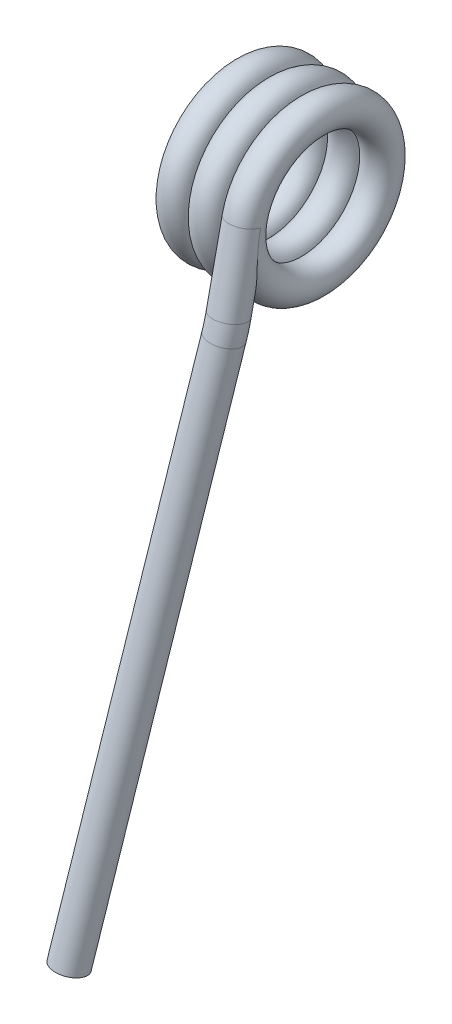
SolidWorks part; units mm, degrees
ref_plane "Front" through (0, 0, 0) normal (0, 0, 1) x (1, 0, 0)
ref_plane "Top" through (0, 0, 0) normal (0, 1, 0) x (1, 0, 0)
ref_plane "Right" through (0, 0, 0) normal (1, 0, 0) x (0, 0, -1)
sketch "Sketch1" plane through (0, 0, 0) normal (0, 0, 1) x (1, 0, 0)
  line L0 (0, 0) -> (-20.6351, 0) construction
  line L1 (0, 3.25) -> (19.7129, 3.25) construction
  line L2 (0.7486, 3.2952) -> (0.7514, 3.2952)
  line L3 (0.7486, 3.2048) -> (0.7514, 3.2048)
  line L4 (2.2486, 3.2952) -> (2.2514, 3.2952)
  line L5 (2.2486, 3.2048) -> (2.2514, 3.2048)
  arc A0 (0.7486, 3.2952) -> (0.7486, 3.2048) centre (0, 3.25) ccw
  arc A1 (0.7514, 3.2048) -> (2.2486, 3.2048) centre (1.5, 3.25) ccw
  arc A2 (2.2514, 3.2048) -> (2.2514, 3.2952) centre (3, 3.25) ccw
  arc A3 (2.2486, 3.2952) -> (0.7514, 3.2952) centre (1.5, 3.25) ccw
  point P7 (0, 2.5)
  dimension "D1" = 1.5
  dimension "D2" = 5
revolve "\"Spring Coil\"- Revolve1" add sketch "Sketch1" angle 360 about L0
ref_plane "End Coil Mid Plane" through (3, 0, 0) normal (1, 0, 0) x (0, 0, -1)
sketch "Tangent Leg Layout" plane through (3, 0, 0) normal (1, 0, 0) x (0, 0, -1)
  line L0 (-3.9126, 0.8316) -> (-2.4454, 0.5198) construction
  line L1 (-2.4454, 0.5198) -> (0, 0) construction
  line L3 (0, 0) -> (-6.6237, 0) construction
  circle A0 centre (0, 0) radius 4
  circle A1 centre (0, 0) radius 2.5
  circle A2 centre (0, 0) radius 2.5 construction
  circle A3 centre (0, 0) radius 4 construction
  circle A4 centre (0, 0) radius 2.5 construction
  point P9 (-3.179, 0.6757)
  dimension "D2" = 12
ref_plane "Torsion Leg Plane" through (3, 0.6757, 3.179) normal (0, -0.2079, -0.9781) x (-1, 0, 0)
sketch "Torsion Leg Sketch" plane through (3, 0.6757, 3.179) normal (0, -0.2079, -0.9781) x (-1, 0, 0)
  line L0 (0, 0) -> (0, -3.5634)
  line L1 (0.0381, -4.4349) -> (2.1789, -28.9049)
  arc A0 (0, -3.5634) -> (0.0381, -4.4349) centre (10, -3.5634) ccw
  point P6 (0, -4)
  dimension "D4" = 10
  dimension "D1" = 4
  dimension "D2" = 5
  dimension "D3" = 25
ref_plane "Sweep Profile Plane" through (3, 0.6757, 3.179) normal (0, -0.9781, 0.2079) x (-1, 0, 0)
sketch "Sketch4" plane through (3, 0.6757, 3.179) normal (0, -0.9781, 0.2079) x (-1, 0, 0)
  circle A0 centre (0, 0) radius 0.75
  dimension "D1" = 1.5
sweep "Torsion Leg- Sweep2" add profiles "Sketch4" path "Torsion Leg Sketch"
combine bodies "Merge Bodies" operation type add bodies to combine 102 101
sketch "For Assembly Mating" plane through (-2.5034, -27.9887, 5.9492) normal (-0.0872, -0.9744, 0.2071) x (0.9962, -0.0853, 0.0181)
  circle A0 centre (3.3372, 3.25) radius 0.75 construction
  point P0 (3.8065, 3.835)
move or copy body "Body-Move/Copy1" [suppressed] bodies to move or copy 103
equation "\"D1@Sketch4\"=\"D1@Sketch1\""
